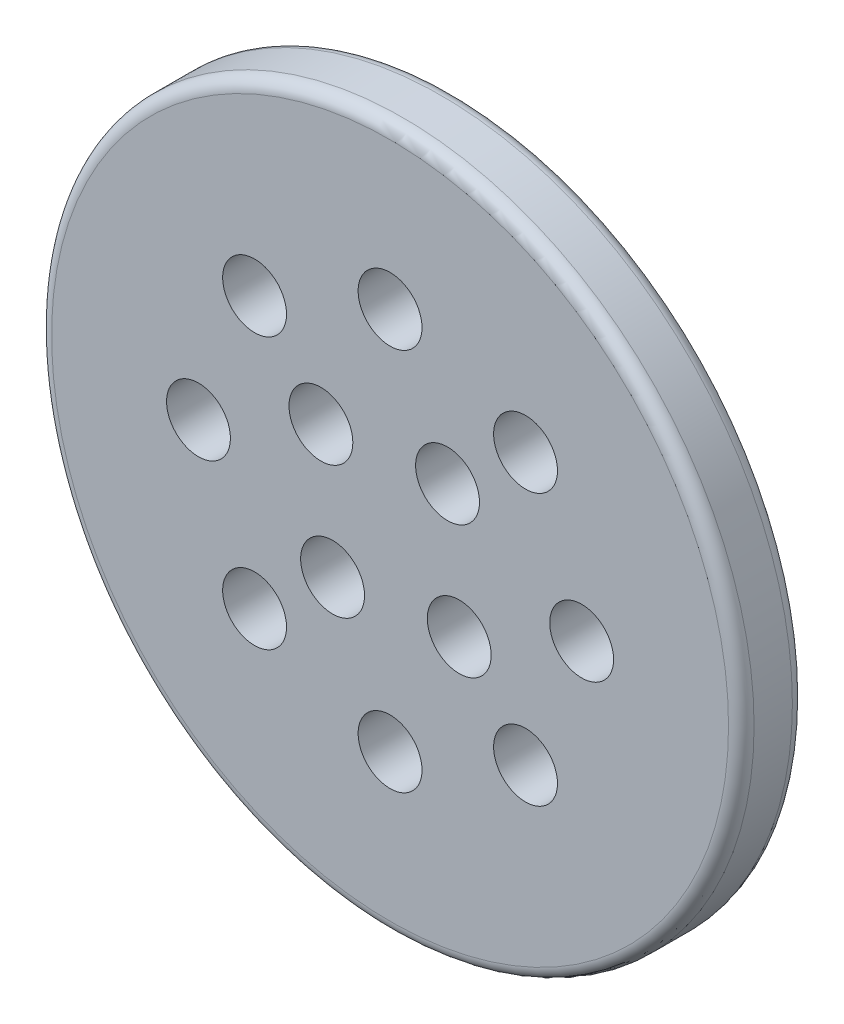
SolidWorks part; units mm, degrees
ref_plane "Front Plane" through (0, 0, 0) normal (0, 0, 1) x (1, 0, 0)
ref_plane "Top Plane" through (0, 0, 0) normal (0, 1, 0) x (1, 0, 0)
ref_plane "Right Plane" through (0, 0, 0) normal (1, 0, 0) x (0, 0, -1)
sketch "Sketch1" plane through (0, 0, 0) normal (0, 0, 1) x (1, 0, 0)
  circle A0 centre (0, 0) radius 275
  circle A1 centre (0, 150) radius 25
  circle A2 centre (106.066, 106.066) radius 25
  circle A3 centre (150, 0) radius 25
  circle A4 centre (106.066, -106.066) radius 25
  circle A5 centre (0, -150) radius 25
  circle A6 centre (-106.066, -106.066) radius 25
  circle A7 centre (-150, 0) radius 25
  circle A8 centre (-106.066, 106.066) radius 25
  circle A9 centre (-54.151, 45) radius 25
  circle A10 centre (45, 54.151) radius 25
  circle A11 centre (54.151, -45) radius 25
  circle A12 centre (-45, -54.151) radius 25
  point P22 (0, 0)
  point P31 (0, 0)
  dimension "D1" = 550
  dimension "D3" = 50
  dimension "D6" = 50
  dimension "D2" = 150
  dimension "D5" = 45
  dimension "D4" = 8
  dimension "D7" = 4
extrude "Boss-Extrude1" add sketch "Sketch1" along normal blind 50
fillet "Fillet1" radius 10 1 edges at (275, 0, 50)
fillet "Fillet2" radius 10 1 edges at (275, 0, 0)
